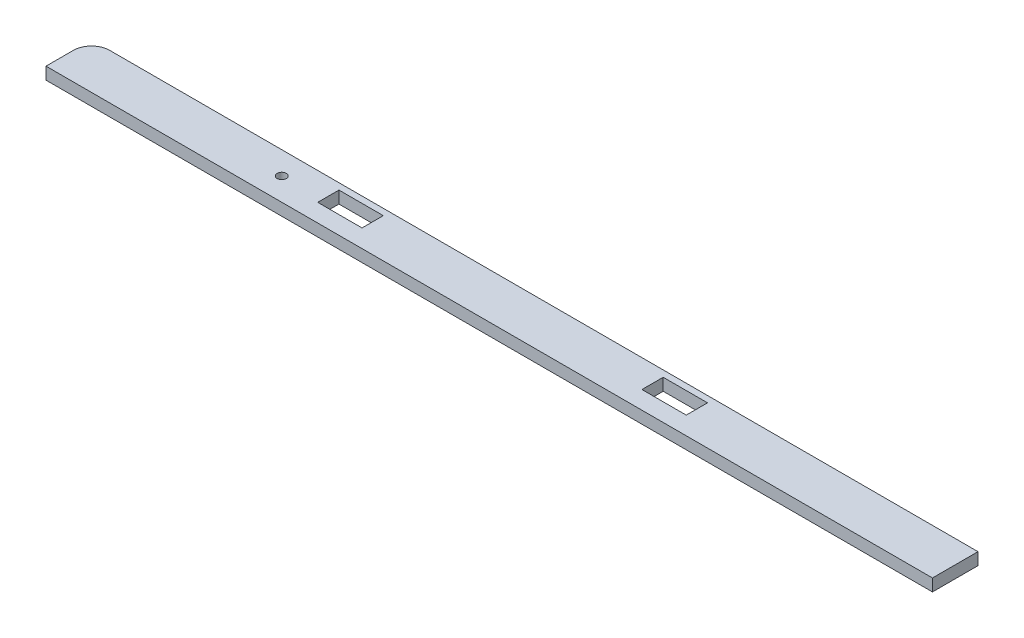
SolidWorks part; units mm, degrees
ref_plane "Front" through (0, 0, 0) normal (0, 0, 1) x (1, 0, 0)
ref_plane "Top" through (0, 0, 0) normal (0, 1, 0) x (1, 0, 0)
ref_plane "Right" through (0, 0, 0) normal (1, 0, 0) x (0, 0, -1)
ref_plane "Plane1" through (0, 3, 0) normal (0, 1, 0) x (1, 0, 0)
sketch "Sketch1" plane through (0, 3, 0) normal (0, 1, 0) x (1, 0, 0)
  line L0 (-141, 106) -> (151, 106)
  line L1 (151, 106) -> (151, 121)
  line L2 (151, 121) -> (-141, 121)
  line L3 (-141, 121) -> (-141, 106)
  circle A0 centre (-70.85, 113.5) radius 1.5
  dimension "D5" = 3
  dimension "D2" = 121
  dimension "D3" = 106
  dimension "D6" = 7.5
extrude "Boss-Extrude1" add sketch "Sketch1" against normal blind 4
sketch "Sketch2" plane through (0, 3, 0) normal (0, 1, 0) x (-1, 0, 0)
  line L0 (-57.4019, -116.9) -> (-53.4, -116.9)
  line L1 (-53.4, -113.9) -> (-57.4019, -113.9)
  line L3 (-49.4, -118.9) -> (-64, -118.9)
  line L4 (-49.4, -118.9) -> (-49.4, -111.9)
  line L5 (-49.4, -111.9) -> (-64, -111.9)
  line L6 (-64, -118.9) -> (-64, -111.9)
  arc A0 (-57.4019, -113.9) -> (-57.4019, -116.9) centre (-60, -115.4) cw
  arc A1 (-53.4, -116.9) -> (-53.4, -113.9) centre (-53.4, -115.4) ccw
  dimension "D3" = 4
  dimension "D4" = 4
  dimension "D1" = 2
  dimension "D2" = 2
extrude "Cut-Extrude1" cut sketch "Sketch2" along direction (0, 1, 0) on the side against the normal through all
sketch "Sketch3" plane through (0, 3, 0) normal (0, 1, 0) x (-1, 0, 0)
  line L0 (49.3981, -116.9) -> (53.4, -116.9)
  line L1 (53.4, -113.9) -> (49.3981, -113.9)
  line L3 (57.4, -118.9) -> (42.8, -118.9)
  line L4 (57.4, -118.9) -> (57.4, -111.9)
  line L5 (57.4, -111.9) -> (42.8, -111.9)
  line L6 (42.8, -118.9) -> (42.8, -111.9)
  arc A0 (49.3981, -113.9) -> (49.3981, -116.9) centre (46.8, -115.4) cw
  arc A1 (53.4, -116.9) -> (53.4, -113.9) centre (53.4, -115.4) ccw
  dimension "D3" = 4
  dimension "D4" = 4
  dimension "D1" = 2
  dimension "D2" = 2
extrude "Cut-Extrude2" cut sketch "Sketch3" against normal through all
fillet "Fillet1" radius 6 1 edges at (-141, 1, -121)
